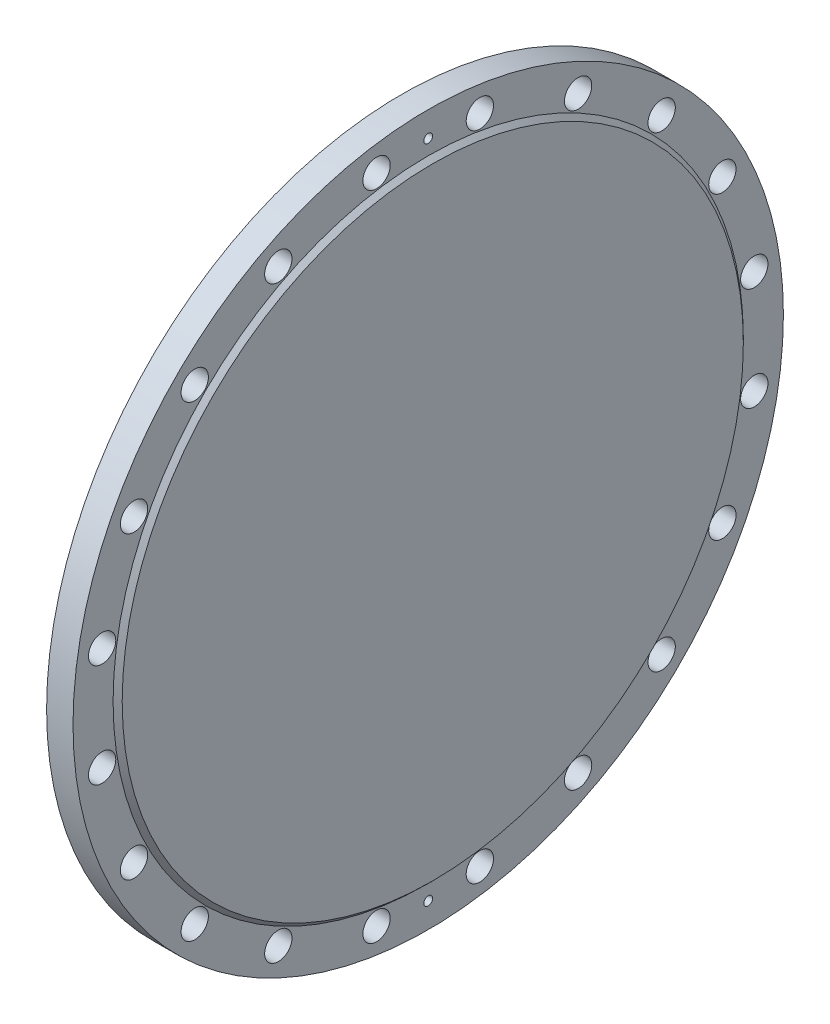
SolidWorks part; units mm, degrees
ref_plane "Plan de face" through (0, 0, 0) normal (0, 0, 1) x (1, 0, 0)
ref_plane "Plan de dessus" through (0, 0, 0) normal (0, 1, 0) x (1, 0, 0)
ref_plane "Plan de droite" through (0, 0, 0) normal (1, 0, 0) x (0, 0, -1)
sketch "Esquisse1" plane through (0, 0, 0) normal (0, 0, 1) x (1, 0, 0)
  line L0 (0, 0) -> (-831.1816, 0) construction
  line L1 (-787, 390) -> (-787, 346)
  line L2 (-816, 390) -> (-787, 390)
  line L3 (-816, 390) -> (-816, 0)
  line L4 (-816, 0) -> (-782, 0)
  line L5 (-782, 341) -> (-782, 0)
  line L6 (-787, 346) -> (-782, 341)
  line L7 (-782, 349) -> (-782, -349) construction
  dimension "D1" = 780
  dimension "D3" = 682
  dimension "D4" = 5
  dimension "D5" = 5
  dimension "D6" = 34
revolve "Révolution1" add sketch "Esquisse1" angle 360 about L0
sketch "Esquisse2" plane through (-816, 0, 0) normal (-1, 0, 0) x (0, 0, 1)
  circle A0 centre (256.3262, 256.3262) radius 15 construction
  circle A1 centre (256.3262, 256.3262) radius 15
  circle A2 centre (322.9899, 164.5716) radius 15 construction
  circle A3 centre (322.9899, 164.5716) radius 15
  circle A4 centre (358.037, 56.7075) radius 15 construction
  circle A5 centre (358.037, 56.7075) radius 15
  circle A6 centre (358.037, -56.7075) radius 15 construction
  circle A7 centre (358.037, -56.7075) radius 15
  circle A8 centre (322.9899, -164.5716) radius 15 construction
  circle A9 centre (322.9899, -164.5716) radius 15
  circle A10 centre (256.3262, -256.3262) radius 15 construction
  circle A11 centre (256.3262, -256.3262) radius 15
  circle A12 centre (164.5716, -322.9899) radius 15 construction
  circle A13 centre (164.5716, -322.9899) radius 15
  circle A14 centre (56.7075, -358.037) radius 15 construction
  circle A15 centre (56.7075, -358.037) radius 15
  circle A16 centre (-56.7075, -358.037) radius 15 construction
  circle A17 centre (-56.7075, -358.037) radius 15
  circle A18 centre (-164.5716, -322.9899) radius 15 construction
  circle A19 centre (-164.5716, -322.9899) radius 15
  circle A20 centre (-256.3262, -256.3262) radius 15 construction
  circle A21 centre (-256.3262, -256.3262) radius 15
  circle A22 centre (-322.9899, -164.5716) radius 15 construction
  circle A23 centre (-322.9899, -164.5716) radius 15
  circle A24 centre (-358.037, -56.7075) radius 15 construction
  circle A25 centre (-358.037, -56.7075) radius 15
  circle A26 centre (-358.037, 56.7075) radius 15 construction
  circle A27 centre (-358.037, 56.7075) radius 15
  circle A28 centre (-322.9899, 164.5716) radius 15 construction
  circle A29 centre (-322.9899, 164.5716) radius 15
  circle A30 centre (-256.3262, 256.3262) radius 15 construction
  circle A31 centre (-256.3262, 256.3262) radius 15
  circle A32 centre (-164.5716, 322.9899) radius 15 construction
  circle A33 centre (-164.5716, 322.9899) radius 15
  circle A34 centre (-56.7075, 358.037) radius 15 construction
  circle A35 centre (-56.7075, 358.037) radius 15
  circle A36 centre (56.7075, 358.037) radius 15 construction
  circle A37 centre (56.7075, 358.037) radius 15
  circle A38 centre (164.5716, 322.9899) radius 15 construction
  circle A39 centre (164.5716, 322.9899) radius 15
extrude "Enlèv. mat.-Extru.1" cut sketch "Esquisse2" against normal through all
sketch "Esquisse3" plane through (-816, 0, 0) normal (-1, 0, 0) x (0, 0, 1)
  circle A0 centre (0, 362.5) radius 4.8
  circle A1 centre (0, -362.5) radius 4.8
  dimension "D2" = 9.6
  dimension "D4" = 9.6
  dimension "D1" = 362.5
  dimension "D3" = 362.5
extrude "Extrusion1" cut sketch "Esquisse3" against normal through all
